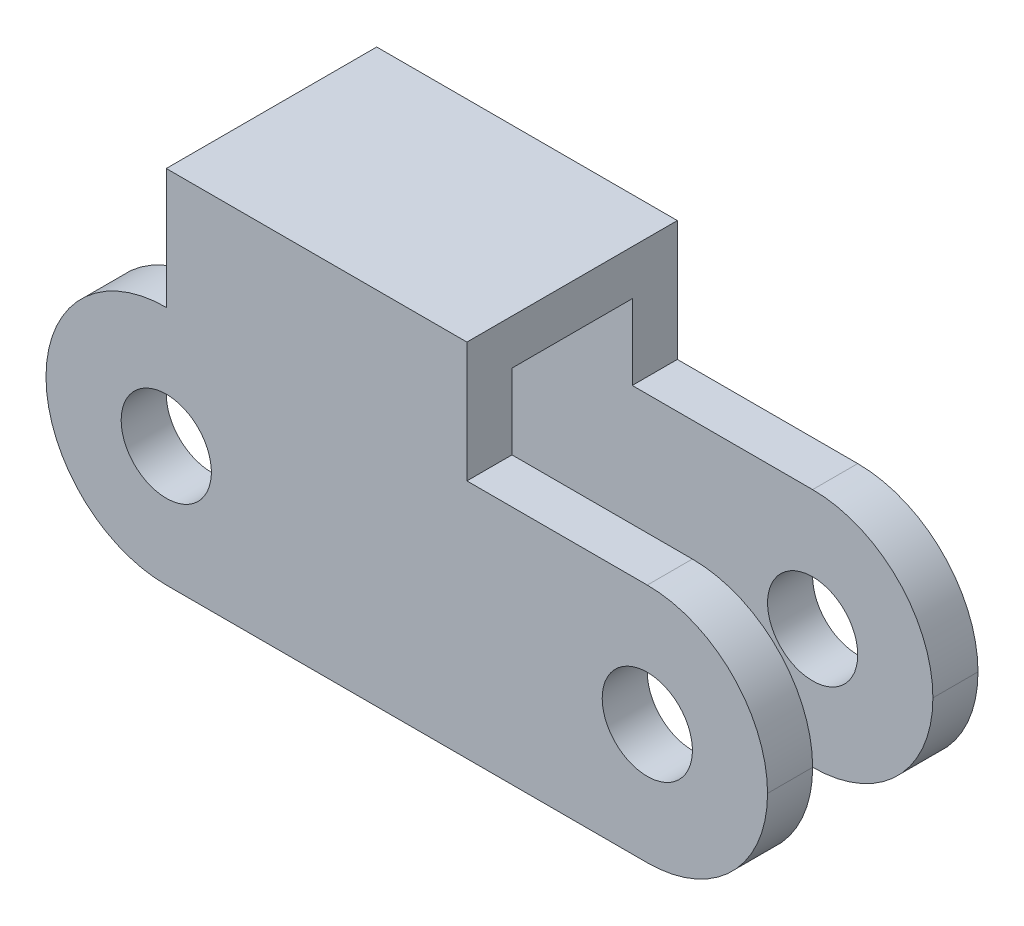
SolidWorks part; units mm, degrees
ref_plane "Front Plane" through (0, 0, 0) normal (0, 0, 1) x (1, 0, 0)
ref_plane "Top Plane" through (0, 0, 0) normal (0, 1, 0) x (1, 0, 0)
ref_plane "Right Plane" through (0, 0, 0) normal (1, 0, 0) x (0, 0, -1)
sketch "Sketch1" plane through (0, 0, 0) normal (0, 0, 1) x (1, 0, 0)
  line L0 (-30.7895, -3.5) -> (-30.7895, 12.5)
  line L1 (-30.7895, 12.5) -> (-22.7895, 12.5)
  line L2 (-22.7895, 12.5) -> (-22.7895, 20.5)
  line L3 (-22.7895, 20.5) -> (-2.7895, 20.5)
  line L4 (-2.7895, 20.5) -> (-2.7895, 12.5)
  line L5 (-2.7895, 12.5) -> (17.2105, 12.5)
  line L6 (17.2105, 12.5) -> (17.2105, -3.5)
  line L7 (17.2105, -3.5) -> (-30.7895, -3.5)
  dimension "D1" = 20
  dimension "D2" = 8
  dimension "D3" = 16
  dimension "D4" = 48
  dimension "D5" = 20
extrude "Boss-Extrude1" add sketch "Sketch1" along normal blind 3
ref_plane "Plane2" through (0, 20.5, 0) normal (0, 1, 0) x (1, 0, 0)
sketch "Sketch5" plane through (0, 20.5, 0) normal (0, 1, 0) x (1, 0, 0)
  line L0 (-2.7895, -3) -> (-22.7895, -3) construction
  line L1 (-7.6942, -3) -> (-5.9461, -3)
  line L3 (-2.7895, -3) -> (-22.7895, -3)
  line L4 (-2.7895, -3) -> (-2.7895, 4)
  line L5 (-2.7895, 4) -> (-22.7895, 4)
  line L6 (-22.7895, -3) -> (-22.7895, 4)
  dimension "D1" = 7
  dimension "D2" = 20
extrude "Boss-Extrude2" add sketch "Sketch5" against normal blind 3 contours L6 L3 L1 L4 L5
ref_plane "Plane5" through (0, 0, -4) normal (0, 0, -1) x (-1, 0, 0)
mirror "Mirror4" about plane through (0, 0, -4) normal (0, 0, -1)
sketch "Sketch6" plane through (0, 0, -11) normal (0, 0, -1) x (-1, 0, 0)
  line L0 (30.7895, -3.5) -> (-17.2105, -3.5) construction
  line L1 (-17.2105, -3.5) -> (-17.2105, 12.5) construction
  circle A0 centre (-9.2106, 4.4779) radius 3
  circle A1 centre (22.7894, 4.5) radius 3
  point P4 (0, 0)
  point P6 (0, 0)
  point P10 (0, 0)
  point P11 (-10.524, 4.5)
  point P12 (-8.2734, 4.5)
  point P15 (-17.2105, 4.5)
  point P17 (0, 0)
  point P18 (0, 0)
  point P20 (0, 0)
  point P21 (0, 0)
  dimension "D1" = 32
  dimension "D3" = 16
  dimension "D4" = 6
  dimension "D2" = 16
  dimension "D5" = 8
extrude "Cut-Extrude1" cut sketch "Sketch6" against normal through all both and the other way through all
fillet "Fillet1" radius 8 8 edges at (17.2105, -3.5, -9.5) (17.2105, 12.5, -9.5) (-30.7895, -3.5, -9.5) (-30.7895, 12.5, -9.5) (-30.7895, -3.5, 1.5) (-30.7895, 12.5, 1.5) (17.2105, -3.5, 1.5) (17.2105, 12.5, 1.5)
